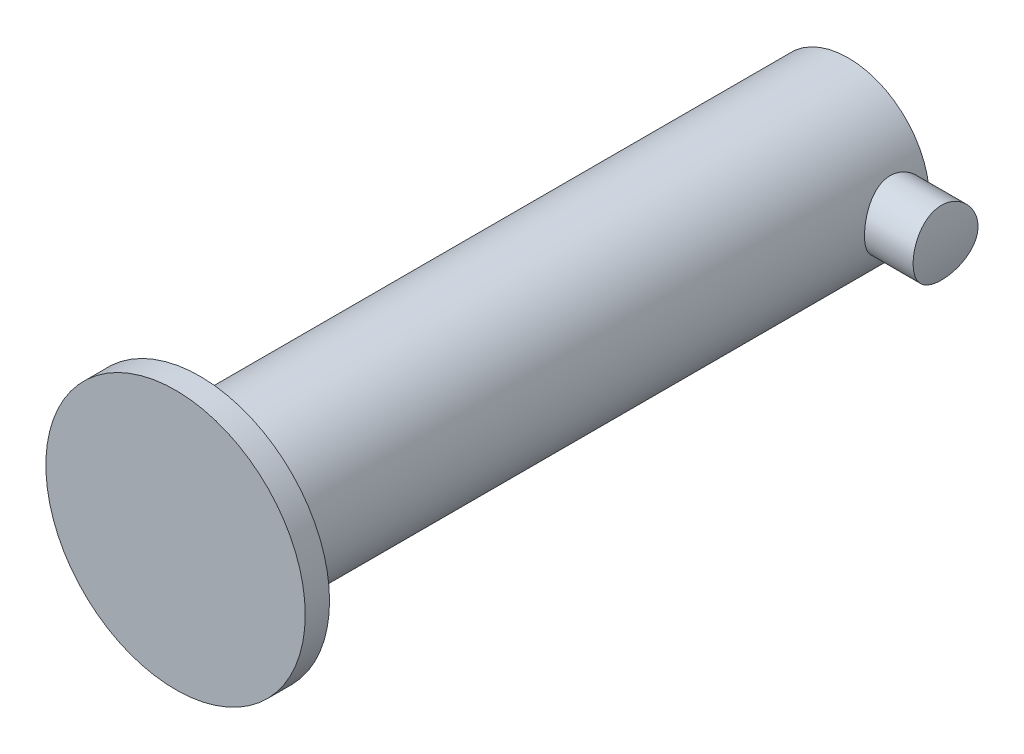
SolidWorks part; units mm, degrees
ref_plane "Plan de face" through (0, 0, 0) normal (0, 0, 1) x (1, 0, 0)
ref_plane "Plan de dessus" through (0, 0, 0) normal (0, 1, 0) x (1, 0, 0)
ref_plane "Plan de droite" through (0, 0, 0) normal (1, 0, 0) x (0, 0, -1)
sketch "Esquisse1" plane through (0, 0, 0) normal (0, 0, 1) x (1, 0, 0)
  circle A0 centre (0, 0) radius 1
  dimension "D1" = 2
extrude "Boss.-Extru.1" add sketch "Esquisse1" along normal blind 8
sketch "Esquisse2" plane through (0, 0, 8) normal (0, 0, 1) x (1, 0, 0)
  circle A0 centre (0, 0) radius 1.6
  dimension "D1" = 3.2
extrude "Boss.-Extru.2" add sketch "Esquisse2" along normal blind 0.3
sketch "Esquisse3" plane through (0, 0, 0) normal (1, 0, 0) x (0, 0, -1)
  line L0 (0, 0) -> (-0.4, 0) construction
  circle A0 centre (-0.4, 0) radius 0.4
  dimension "D1" = 0.8
extrude "Boss.-Extru.3" add sketch "Esquisse3" along normal blind 1.6
sketch "Esquisse4" plane through (0, 0, 0) normal (0, 0, -1) x (-1, 0, 0)
  circle A0 centre (0, 0) radius 1.6
  circle A1 centre (0, 0) radius 2.1217
  circle A2 centre (0, 0) radius 1.6 construction
extrude "Enlèv. mat.-Extru.1" cut sketch "Esquisse4" against normal blind 1.6
sketch "Esquisse5" plane through (0, 0, 0) normal (0, 0, -1) x (-1, 0, 0)
  circle A0 centre (0, 0) radius 0.7
  circle A1 centre (0, 0) radius 1 construction
  dimension "D1" = 0.3
extrude "Enlèv. mat.-Extru.2" cut sketch "Esquisse5" against normal up to surface (8 mm away)
